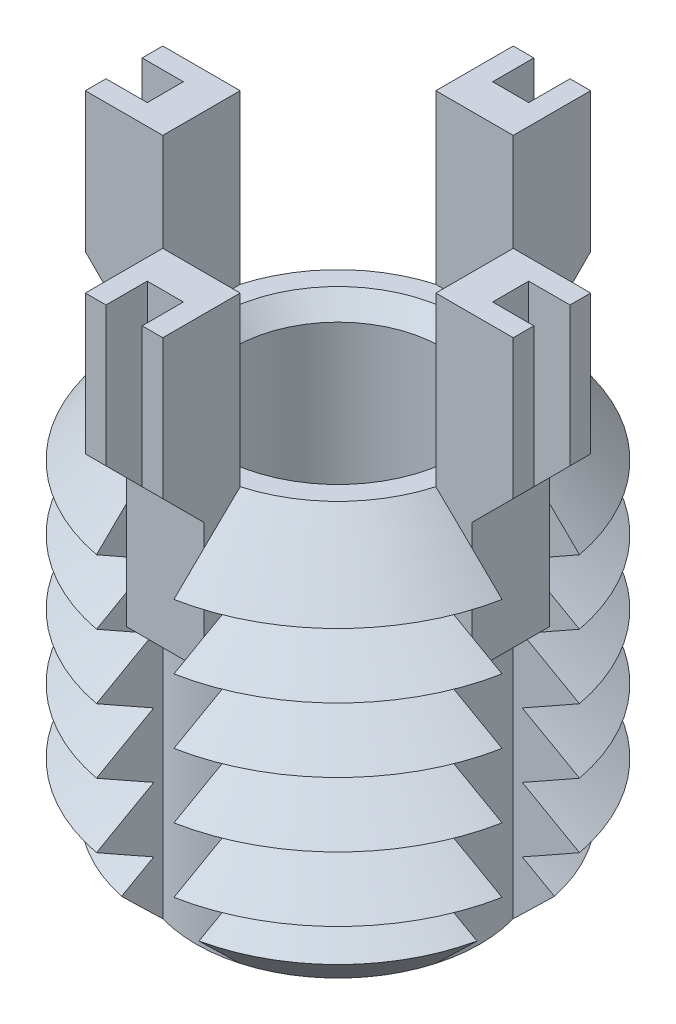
SolidWorks part; units mm, degrees
ref_plane "Front Plane" through (0, 0, 0) normal (0, 0, 1) x (1, 0, 0)
ref_plane "Top Plane" through (0, 0, 0) normal (0, 1, 0) x (1, 0, 0)
ref_plane "Right Plane" through (0, 0, 0) normal (1, 0, 0) x (0, 0, -1)
sketch "Sketch1" plane through (0, 0, 0) normal (0, 1, 0) x (1, 0, 0)
  circle A0 centre (0, 0) radius 4
  dimension "D1" = 8
extrude "Boss-Extrude1" add sketch "Sketch1" against normal blind 8
chamfer "Chamfer1" distance 1.25 angle 45 2 edges at (0, -8, 4) (0, 0, 4)
sketch "Sketch2" plane through (0, 0, 0) normal (1, 0, 0) x (0, 0, -1)
  line L0 (0, 0.8859) -> (0, -9.2617) construction
sketch "Sketch3" plane through (0, 0, 0) normal (1, 0, 0) x (0, 0, -1)
  line L0 (-4, -1.25) -> (-2.9175, -1.875)
  line L1 (-2.9175, -1.875) -> (-4, -2.5)
  line L2 (-4, -1.25) -> (-4, -6.75) construction
  line L3 (-4, -2.5) -> (-4, -1.25)
  dimension "D1" = 1.25
revolve "Cut-Revolve1" cut sketch "Sketch3" angle 360 about L0
pattern_linear "LPattern1" count 5 spacing 1.25 along (0, -1, 0) of "Cut-Revolve1"
sketch "Sketch4" plane through (0, 0, 0) normal (0, 1, 0) x (1, 0, 0)
  line L0 (-2.6458, 0.75) -> (-3.9291, 0.75)
  line L2 (-3.9291, -0.75) -> (-2.6458, -0.75)
  arc A0 (-2.6458, 0.75) -> (-2.6458, -0.75) centre (0, 0) ccw
  arc A1 (-3.9291, 0.75) -> (-3.9291, -0.75) centre (0, 0) ccw
  circle A2 centre (0, 0) radius 4 construction
  circle A3 centre (0, 0) radius 2.75 construction
  point P1 (-2.75, 0)
  point P3 (-4, 0)
  point P13 (0, 0)
  dimension "D1" = 1.5
extrude "Cut-Extrude1" cut sketch "Sketch4" against normal up to surface (8 mm away)
pattern_circular "CirPattern1" count 4 over 360 about axis through (0, 0, 0) along (0, 1, 0) of "Cut-Extrude1"
sketch "Sketch5" plane through (0, 0, 0) normal (1, 0, 0) x (0, 0, -1)
  line L0 (-2.6458, 3.25) -> (-2.6458, -2.75)
  line L1 (-2.6458, -2.75) -> (-3.3458, -2.75)
  line L2 (-3.3458, -2.75) -> (-3.3458, -0.25)
  line L3 (-3.3458, -0.25) -> (-4.1458, 0.55)
  line L4 (-4.1458, 0.55) -> (-4.1458, 3.25)
  line L5 (-4.1458, 3.25) -> (-2.6458, 3.25)
  line L6 (-3.9291, -3.75) -> (-0.75, -3.75) construction
  point P9 (-0.75, 0)
  point P10 (-3.3458, -0.25)
  dimension "D1" = 1
  dimension "D2" = 6
  dimension "D3" = 3.5
  dimension "D4" = 1.5
  dimension "D5" = 0.7
  dimension "D6" = 45
extrude "Boss-Extrude3" add sketch "Sketch5" along normal mid plane 1.5
pattern_circular "CirPattern2" count 4 over 360 about axis through (0, 0, 0) along (0, 1, 0) of "Boss-Extrude3"
sketch "Sketch6" plane through (0, 3.25, 0) normal (0, 1, 0) x (1, 0, 0)
  line L0 (-4.1458, -0.75) -> (-4.1458, 0.75) construction
  line L1 (-4.1458, -0.35) -> (-3.3458, -0.35)
  line L2 (-4.1458, -0.35) -> (-4.1458, 0.35)
  line L3 (-4.1458, 0.35) -> (-3.3458, 0.35)
  line L4 (-3.3458, -0.35) -> (-3.3458, 0.35)
  line L5 (-4.1458, -0.35) -> (-3.3458, 0.35) construction
  line L6 (-4.1458, 0.35) -> (-3.3458, -0.35) construction
  line L7 (4.1458, 0.75) -> (4.1458, -0.75) construction
  line L8 (-0.35, 3.3458) -> (0.35, 3.3458)
  line L9 (-0.35, 3.3458) -> (-0.35, 4.1458)
  line L10 (-0.35, 4.1458) -> (0.35, 4.1458)
  line L11 (0.35, 3.3458) -> (0.35, 4.1458)
  line L12 (-0.35, 3.3458) -> (0.35, 4.1458) construction
  line L13 (-0.35, 4.1458) -> (0.35, 3.3458) construction
  line L14 (3.3458, -0.35) -> (4.1458, -0.35)
  line L15 (3.3458, -0.35) -> (3.3458, 0.35)
  line L16 (3.3458, 0.35) -> (4.1458, 0.35)
  line L17 (4.1458, -0.35) -> (4.1458, 0.35)
  line L18 (3.3458, -0.35) -> (4.1458, 0.35) construction
  line L19 (3.3458, 0.35) -> (4.1458, -0.35) construction
  line L20 (-0.35, -4.1458) -> (0.35, -4.1458)
  line L21 (-0.35, -4.1458) -> (-0.35, -3.3458)
  line L22 (-0.35, -3.3458) -> (0.35, -3.3458)
  line L23 (0.35, -4.1458) -> (0.35, -3.3458)
  line L24 (-0.35, -4.1458) -> (0.35, -3.3458) construction
  line L25 (-0.35, -3.3458) -> (0.35, -4.1458) construction
  line L26 (-0.75, 4.1458) -> (0.75, 4.1458) construction
  line L27 (0.75, -4.1458) -> (-0.75, -4.1458) construction
  point P0 (-3.7458, 0)
  point P7 (-4.1458, 0)
  point P8 (-4.1458, 0)
  point P9 (0, 3.7458)
  point P14 (3.7458, 0)
  point P19 (0, -3.7458)
  point P24 (0, 4.1458)
  point P25 (4.1458, 0)
  point P26 (4.1458, 0)
  point P27 (0, 4.1458)
  point P30 (0, -4.1458)
  point P33 (0, -4.1458)
  dimension "D1" = 0.7
  dimension "D2" = 0.8
extrude "Cut-Extrude3" cut sketch "Sketch6" against normal through all both and the other way through all
sketch "Sketch7" plane through (0, 0, 0) normal (0, 1, 0) x (1, 0, 0)
  circle A0 centre (0, 0) radius 2
  dimension "D1" = 4
extrude "Cut-Extrude4" cut sketch "Sketch7" against normal up to surface (8 mm away)
chamfer "Chamfer2" distance 0.35 angle 45 2 edges at (0, 0, 2) (0, -8, 2)
